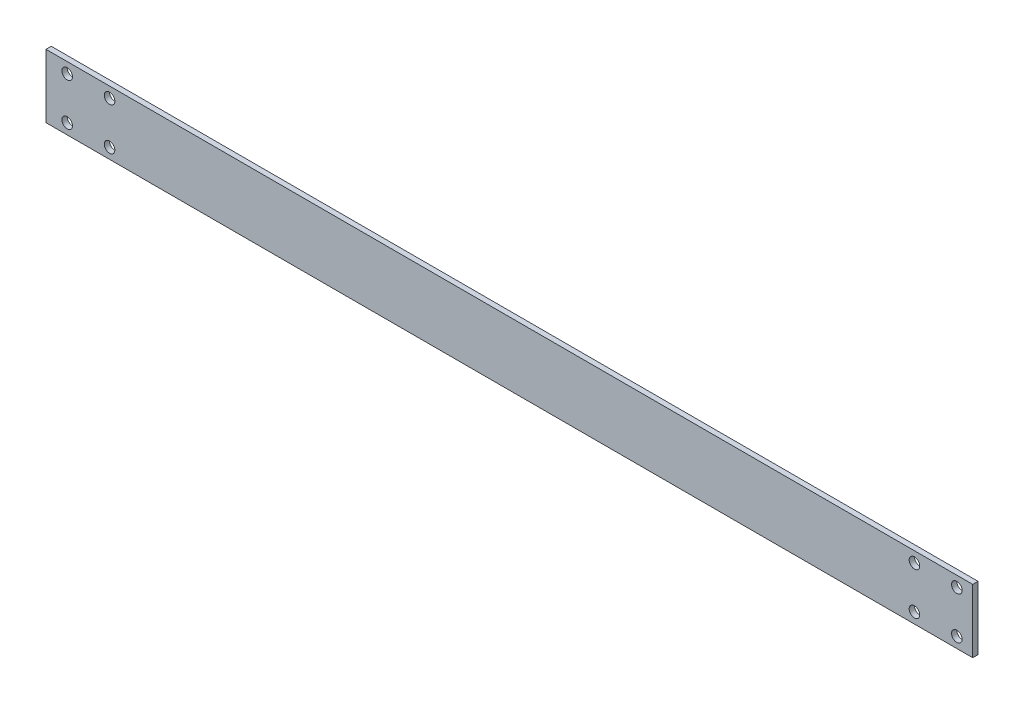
SolidWorks part; units mm, degrees
ref_plane "Front" through (0, 0, 0) normal (0, 0, 1) x (1, 0, 0)
ref_plane "Top" through (0, 0, 0) normal (0, 1, 0) x (1, 0, 0)
ref_plane "Right" through (0, 0, 0) normal (1, 0, 0) x (0, 0, -1)
sketch "草图1" plane through (0, 0, 0) normal (0, 0, 1) x (1, 0, 0)
  line L1 (0, 0) -> (350, 0)
  line L2 (0, 0) -> (0, 24)
  line L3 (0, 24) -> (350, 24)
  line L7 (350, 0) -> (350, 24)
  circle A0 centre (8, 20) radius 2
  circle A1 centre (24, 20) radius 2
  circle A2 centre (24, 4) radius 2
  circle A3 centre (8, 4) radius 2
  circle A4 centre (344, 4) radius 2
  circle A5 centre (328, 4) radius 2
  circle A6 centre (328, 20) radius 2
  circle A7 centre (344, 20) radius 2
  point P25 (175, 0)
  dimension "D1" = 4
  dimension "D5" = 4
  dimension "D6" = 2
  dimension "D2" = 8
  dimension "D3" = 24
  dimension "D4" = 350
  dimension "D8" = 4
  dimension "D9" = 6
  dimension "D10" = 6
  dimension "D11" = 16
  dimension "D12" = 16
  dimension "D13" = 16
  dimension "D7" = 2
extrude "凸台-拉伸2" add sketch "草图1" along normal blind 2
